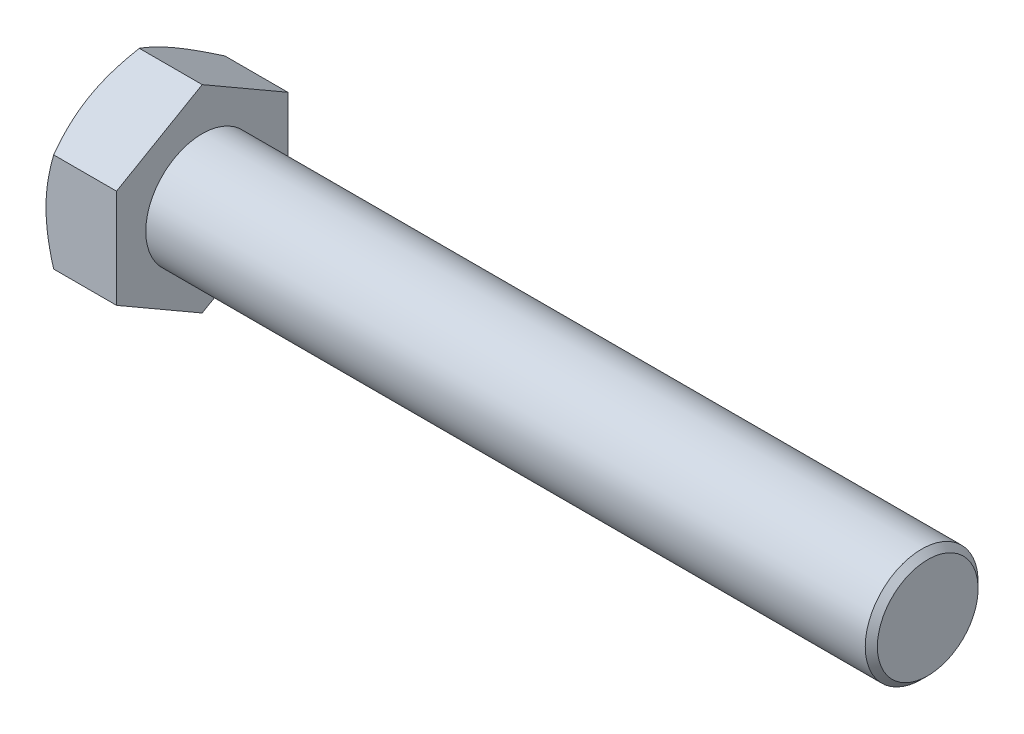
SolidWorks part; units mm, degrees
ref_plane "Front Plane" through (0, 0, 0) normal (0, 0, 1) x (1, 0, 0)
ref_plane "Top Plane" through (0, 0, 0) normal (0, 1, 0) x (1, 0, 0)
ref_plane "Right Plane" through (0, 0, 0) normal (1, 0, 0) x (0, 0, -1)
sketch "BaseHeadSke" plane through (0, 0, 0) normal (1, 0, 0) x (0, 0, -1)
  line L1 (0, 49.0748) -> (-42.5, 24.5374)
  line L2 (-42.5, 24.5374) -> (-42.5, -24.5374)
  line L3 (-42.5, -24.5374) -> (0, -49.0748)
  line L4 (0, -49.0748) -> (42.5, -24.5374)
  line L5 (42.5, -24.5374) -> (42.5, 24.5374)
  line L6 (42.5, 24.5374) -> (0, 49.0748)
  circle A0 centre (0, 0) radius 42.5 construction
  dimension "Width_flats" = 85
extrude "BaseHead" add sketch "BaseHeadSke" along normal blind 35
sketch "HeadChamferSke" plane through (0, 0, 0) normal (0, 0, 1) x (1, 0, 0)
  line L0 (0, 0) -> (108.1848, 0) construction
  line L1 (0, 24.5374) -> (0, -24.5374) construction
  line L2 (0, 49.0748) -> (0, 42.5)
  line L3 (0, 42.5) -> (3.7959, 49.0748)
  line L4 (3.7959, 49.0748) -> (0, 49.0748)
  line L7 (35, 49.0748) -> (0, 49.0748) construction
  dimension "Angle_Chamfer_Head" = 30
revolve "HeadChamfer" cut sketch "HeadChamferSke" angle 360 about L0
sketch "BodySke" plane through (0, 0, 0) normal (0, 0, 1) x (1, 0, 0)
  line L0 (0, 0) -> (440.8544, 0) construction
  line L1 (0, 0) -> (0, 28)
  line L3 (0, 36.8061) -> (0, 0) construction
  line L4 (0, 28) -> (391.9855, 28)
  line L5 (391.9855, 28) -> (395, 24.9855)
  line L6 (395, 24.9855) -> (395, 0)
  line L7 (395, 0) -> (0, 0)
  line L8 (40.5, 0) -> (40.5, 20.794) construction
  line L9 (35, 24.5374) -> (35, -24.5374) construction
  line L10 (35, 0) -> (35, 20.794) construction
  dimension "Advance" = 5.5
  dimension "Length" = 360
  dimension "Diameter" = 56
  dimension "Thread_minor" = 49.971
  dimension "Body_Chamfer_Angle" = 45
  dimension "Thread_length" = 360
revolve "BaseBody" add sketch "BodySke" angle 360 about L0
sketch "BearingFaceSke" plane through (0, 0, 0) normal (0, 0, 1) x (1, 0, 0)
  line L0 (0, 0) -> (414.2241, 0) construction
  line L1 (35, 49.0748) -> (35, 24.5374) construction
  line L2 (35, 42.5) -> (34, 42.5)
  line L3 (35, 42.5) -> (35, 52.5)
  line L4 (35, 52.5) -> (34, 52.5)
  line L5 (34, 42.5) -> (34, 52.5)
  dimension "D1" = 10
  dimension "D2" = 85
  dimension "Bearing_height" = 1
revolve "BearingFace" [suppressed] cut sketch "BearingFaceSke" angle 360 about L0
fillet "HeadFillet" [suppressed] radius 2
sketch "ThdSchSke" plane through (0, 0, 0) normal (0, 0, 1) x (1, 0, 0)
  line L0 (0, 0) -> (453.2163, 0) construction
  line L1 (386.4855, 31.4808) -> (386.4855, 28)
  line L2 (386.4855, 31.4808) -> (389.9663, 31.4808)
  line L3 (389.9663, 31.4808) -> (389.9663, 28)
  line L4 (389.9663, 28) -> (388.2259, 24.9855)
  line L5 (388.2259, 24.9855) -> (386.4855, 28)
  dimension "D1" = 5.5
revolve "ThreadSchematic" [suppressed] cut sketch "ThdSchSke" angle 360 about L0
pattern_linear "ThdSchPat" [suppressed]
equation "\"Thread_minor@ThreadCosmetic\" = \"Thread_minor@BodySke\""
equation "\"D2@BearingFaceSke\" = \"Width_flats@BaseHeadSke\""
equation "\"D1@ThdSchSke\" = \"Advance@BodySke\""
equation "\"Advance@ThdSchPat\" = \"Advance@BodySke\""
equation "\"Tooth_Num@ThdSchPat\" =  int( \"Thread_length@BodySke\" / \"Advance@BodySke\" ) - 1 "
